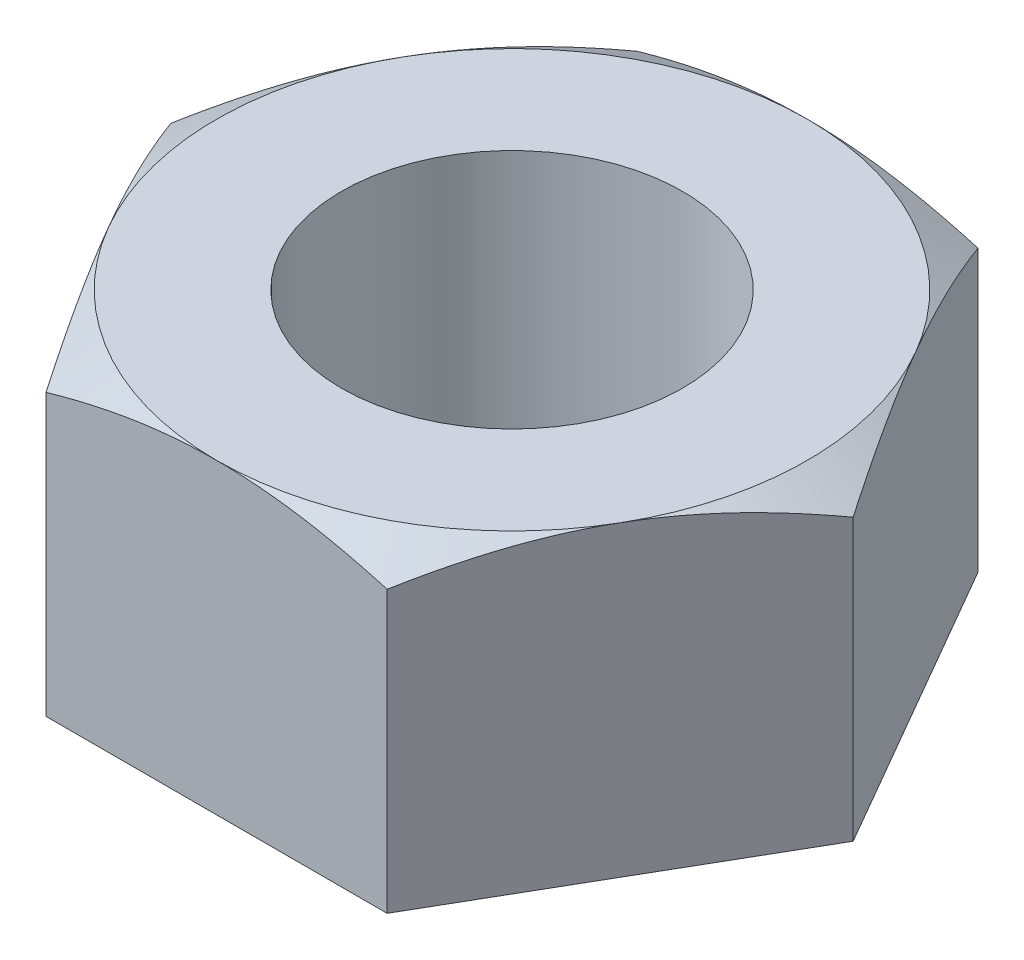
SolidWorks part; units mm, degrees
ref_plane "Front" through (0, 0, 0) normal (0, 0, 1) x (1, 0, 0)
ref_plane "Top" through (0, 0, 0) normal (0, 1, 0) x (1, 0, 0)
ref_plane "Right" through (0, 0, 0) normal (1, 0, 0) x (0, 0, -1)
sketch "Sketch1" plane through (0, 0, 0) normal (0, 1, 0) x (1, 0, 0)
  line L1 (10, 0) -> (5, 8.6603)
  line L2 (5, 8.6603) -> (-5, 8.6603)
  line L3 (-5, 8.6603) -> (-10, 0)
  line L4 (-10, 0) -> (-5, -8.6603)
  line L5 (-5, -8.6603) -> (5, -8.6603)
  line L6 (5, -8.6603) -> (10, 0)
  circle A0 centre (0, 0) radius 10 construction
  circle A1 centre (0, 0) radius 5
extrude "Extrude1" add sketch "Sketch1" along normal blind 9
sketch "Sketch4" plane through (0, 9, 0) normal (0, 1, 0) x (-1, 0, 0)
  circle A0 centre (0, 0) radius 8.6603 construction
  point P3 (-8.6603, 0)
sketch "Sketch6" plane through (0, 0, 0) normal (0, 0, 1) x (1, 0, 0)
  line L0 (0, 9) -> (0, 0) construction
  line L1 (8.6603, 9) -> (-8.6603, 9) construction
  line L2 (8.6603, 9) -> (13.8055, 9)
  line L3 (13.8055, 9) -> (12.1804, 6.9676)
  line L4 (8.6603, 9) -> (12.1804, 6.9676)
  dimension "D1" = 30
revolve "Cut-Revolve6" cut sketch "Sketch6" angle 360 about L0
